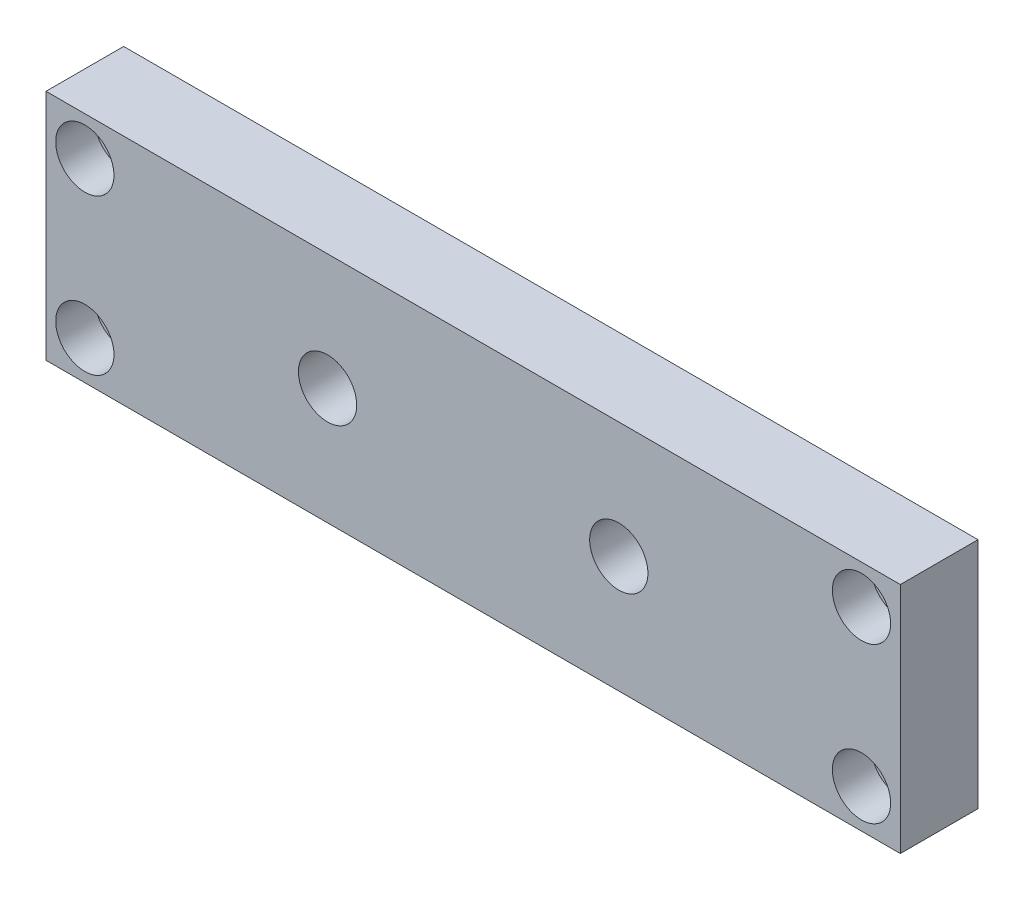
SolidWorks part; units mm, degrees
ref_plane "Front Plane" through (0, 0, 0) normal (0, 0, 1) x (1, 0, 0)
ref_plane "Top Plane" through (0, 0, 0) normal (0, 1, 0) x (1, 0, 0)
ref_plane "Right Plane" through (0, 0, 0) normal (1, 0, 0) x (0, 0, -1)
sketch "Sketch1" plane through (0, 0, 0) normal (0, 0, 1) x (1, 0, 0)
  line L0 (0, 0) -> (0, 34.2002) construction
  line L1 (-69.85, -19.05) -> (69.85, -19.05)
  line L2 (69.85, -19.05) -> (69.85, 19.05)
  line L3 (69.85, 19.05) -> (-69.85, 19.05)
  line L4 (-69.85, 19.05) -> (-69.85, -19.05)
  line L5 (0, 0) -> (13.8096, 0) construction
  circle A0 centre (-63.5, 12.7) radius 3.175
  circle A1 centre (-63.5, -12.7) radius 3.175
  circle A2 centre (63.5, 12.7) radius 3.175
  circle A3 centre (63.5, -12.7) radius 3.175
  circle A4 centre (-23.8125, 0) radius 4.7625
  circle A5 centre (23.8125, 0) radius 4.7625
  dimension "D3" = 6.35
  dimension "D7" = 9.525
  dimension "D1" = 38.1
  dimension "D2" = 139.7
  dimension "D4" = 25.4
  dimension "D5" = 127
  dimension "D6" = 47.625
extrude "Boss-Extrude1" add sketch "Sketch1" along normal blind 12.7
sketch "Sketch2" plane through (0, 0, 12.7) normal (0, 0, 1) x (1, 0, 0)
  circle A0 centre (-63.5, 12.7) radius 4.7625
  circle A1 centre (-63.5, -12.7) radius 4.7625
  circle A2 centre (63.5, -12.7) radius 4.7625
  circle A3 centre (63.5, 12.7) radius 4.7625
  dimension "D1" = 9.525
extrude "Cut-Extrude1" cut sketch "Sketch2" against normal blind 6.35
sketch "Sketch3" plane through (0, -19.05, 0) normal (0, -1, 0) x (1, 0, 0)
  circle A0 centre (0, 6.35) radius 3.175
  dimension "D2" = 6.35
  dimension "D1" = 6.35
extrude "Cut-Extrude2" cut sketch "Sketch3" against normal blind 20.32
chamfer "Chamfer1" distance 1.778 angle 59 1 edges at (0, 1.27, 3.175)
